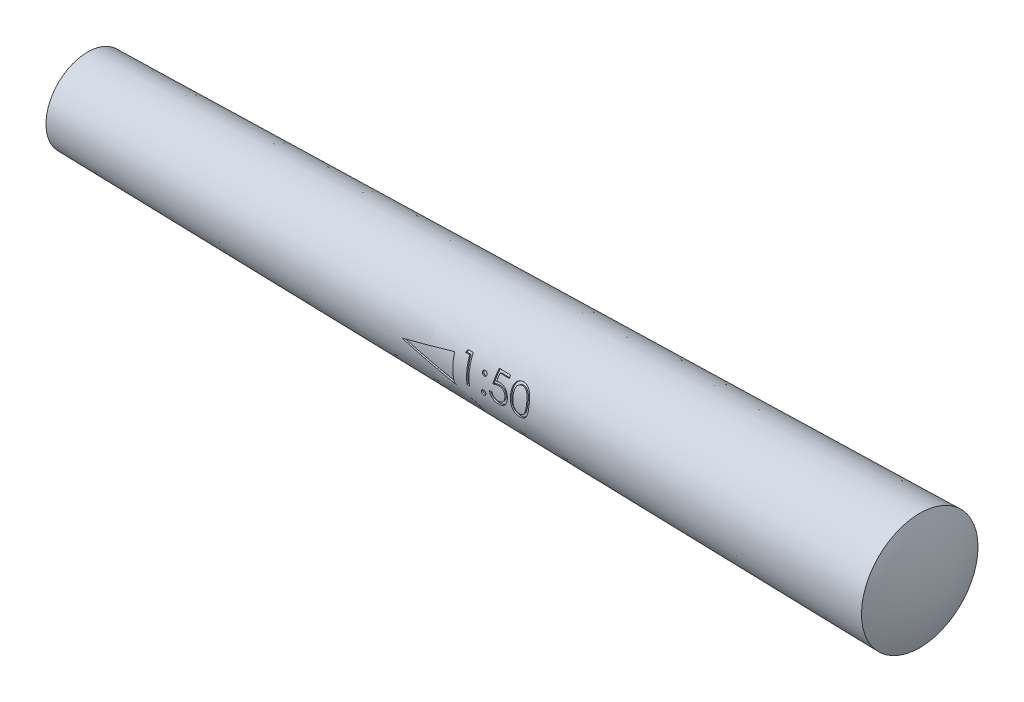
SolidWorks part; units mm, degrees
ref_plane "Front Plane" through (0, 0, 0) normal (0, 0, 1) x (1, 0, 0)
ref_plane "Top Plane" through (0, 0, 0) normal (0, 1, 0) x (1, 0, 0)
ref_plane "Right Plane" through (0, 0, 0) normal (1, 0, 0) x (0, 0, -1)
sketch "Sketch1" plane through (0, 0, 0) normal (1, 0, 0) x (0, 0, -1)
  circle A0 centre (0, 0) radius 1.5
  dimension "D1" = 3
extrude "Extrude1" add sketch "Sketch1" along normal mid plane 30
draft "Draft1" type of draft neutral plane draft angle 1.146 faces to draft 1 parameters "D1"=1.146
sketch "Sketch2" plane through (0, 0, 0) normal (0, 0, 1) x (1, 0, 0)
  line L0 (-15, 0) -> (-15, 1.5)
  line L1 (-15, 1.5) -> (-15, -1.5) construction
  line L2 (-15, 0) -> (-15.45, 0)
  line L3 (-15.45, 0) -> (-15.45, -1.8) construction
  line L4 (15, 0) -> (15, 2.1)
  line L5 (15, -2.1) -> (15, 2.1) construction
  line L6 (15, 0) -> (15.45, 0)
  line L7 (15.45, 0) -> (15.45, -1.8) construction
  line L8 (-15, -1.5) -> (15, -2.1) construction
  arc A0 (-15.45, 0) -> (-15, 1.5) centre (-12.725, 0) cw
  arc A1 (15.45, 0) -> (15, 2.1) centre (10.3249, 0) ccw
  point P14 (0, -1.8)
revolve "Revolve1" add sketch "Sketch2" angle 360 about L2
sketch "Sketch5" plane through (0, 0, 0) normal (0, 0, 1) x (1, 0, 0)
  line L0 (0, 1.8) -> (0, -1.8) construction
  line L1 (15, 2.1) -> (-15, 1.5) construction
  line L2 (-15, -1.5) -> (15, -2.1) construction
ref_plane "Plane2" through (0, 0, 0) normal (-0.02, 0, 0.9998) x (0.9998, 0, 0.02)
sketch "Sketch6" plane through (0, 0, 0) normal (-0.02, 0, 0.9998) x (0.9998, 0, 0.02)
  line L0 (0, 0) -> (0, 0.5)
  line L1 (0, 1.8) -> (0, -1.8) construction
  line L2 (0, 0.5) -> (-1.866, 0)
  line L3 (-1.866, 0) -> (0, -0.5)
  line L4 (0, -0.5) -> (0, 0)
  line L5 (0, -0.25) -> (3, -0.25) construction
  text T0 "1:50" font "Century Gothic" height 1
  dimension "D1" = 1
  dimension "D2" = 30
  dimension "D3" = 3
wrap "Wrap2" sketch "Sketch6" wrap type deboss source sketch "Sketch6" thickness 0.05 parameters "D1"=0.05
equation "\"D2@Sketch2\" = \"D1@Sketch2\""
